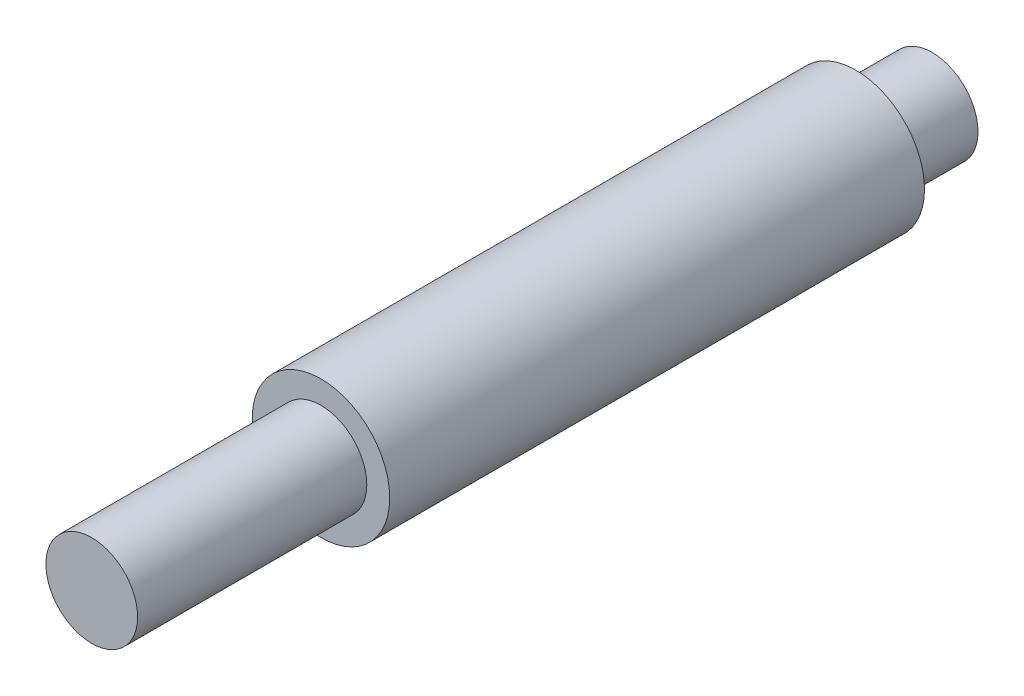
SolidWorks part; units mm, degrees
ref_plane "前视基准面" through (0, 0, 0) normal (0, 0, 1) x (1, 0, 0)
ref_plane "上视基准面" through (0, 0, 0) normal (0, 1, 0) x (1, 0, 0)
ref_plane "右视基准面" through (0, 0, 0) normal (1, 0, 0) x (0, 0, -1)
sketch "草图1" plane through (0, 0, 0) normal (0, 0, 1) x (1, 0, 0)
  circle A0 centre (0, 0) radius 6
extrude "凸台-拉伸1" add sketch "草图1" along normal blind 10
sketch "草图2" plane through (0, 0, 10) normal (0, 0, 1) x (1, 0, 0)
  circle A0 centre (0, 0) radius 9
extrude "凸台-拉伸2" add sketch "草图2" along normal blind 70
sketch "草图3" plane through (0, 0, 80) normal (0, 0, 1) x (1, 0, 0)
  circle A0 centre (0, 0) radius 6
extrude "凸台-拉伸3" add sketch "草图3" along normal blind 30
